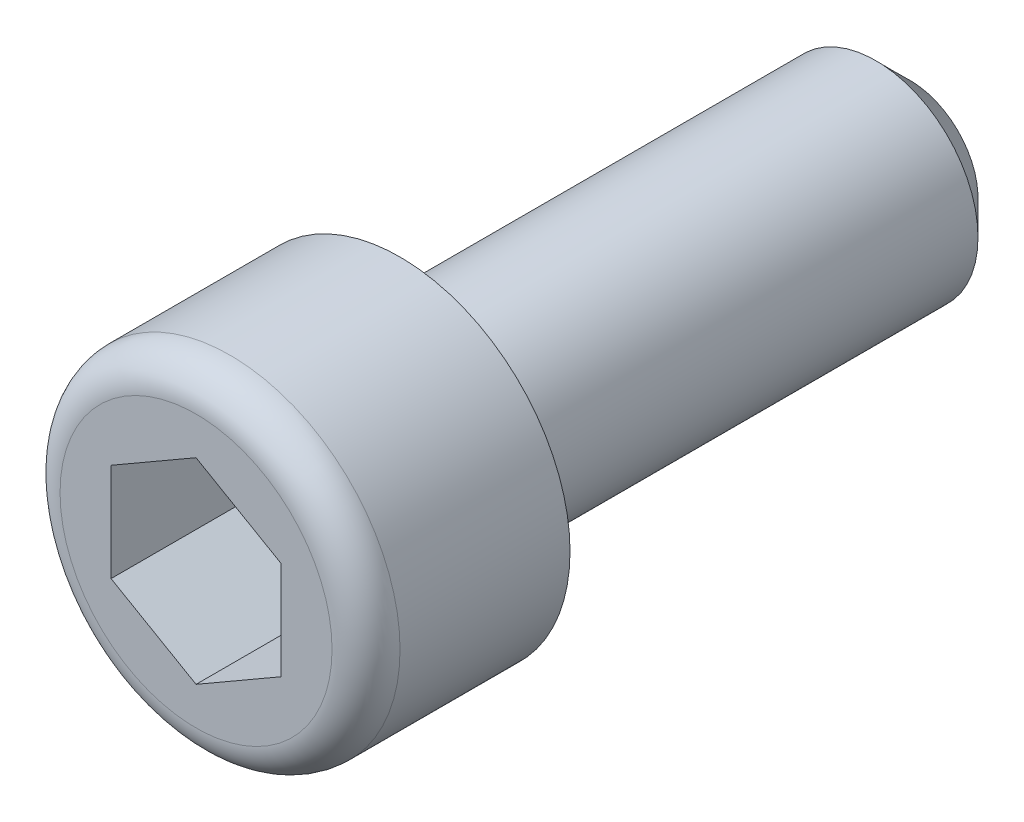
SolidWorks part; units mm, degrees
ref_plane "Face" through (0, 0, 0) normal (0, 0, 1) x (1, 0, 0)
ref_plane "Dessus" through (0, 0, 0) normal (0, 1, 0) x (1, 0, 0)
ref_plane "Droite" through (0, 0, 0) normal (1, 0, 0) x (0, 0, -1)
sketch "Esquisse1" plane through (0, 0, 0) normal (0, 0, 1) x (1, 0, 0)
  circle A0 centre (0, 0) radius 5
  dimension "D1" = 10
extrude "Base-Extrusion" add sketch "Esquisse1" against normal blind 6
sketch "Esquisse2" plane through (0, 0, -6) normal (0, 0, -1) x (-1, 0, 0)
  circle A0 centre (0, 0) radius 3
  dimension "D1" = 6
extrude "Boss.-Extru.1" add sketch "Esquisse2" along normal blind 15
chamfer "Chanfrein1" distance 1 angle 45 1 edges at (-3, 0, -21)
sketch "Esquisse3" plane through (0, 0, 0) normal (0, 0, 1) x (1, 0, 0)
  line L1 (-2.5, -1.4434) -> (0, -2.8868)
  line L2 (0, -2.8868) -> (2.5, -1.4434)
  line L3 (2.5, -1.4434) -> (2.5, 1.4434)
  line L4 (2.5, 1.4434) -> (0, 2.8868)
  line L5 (0, 2.8868) -> (-2.5, 1.4434)
  line L6 (-2.5, 1.4434) -> (-2.5, -1.4434)
  circle A0 centre (0, 0) radius 2.5 construction
  dimension "D1" = 5
extrude "Enlèv. mat.-Extru.1" cut sketch "Esquisse3" against normal blind 4
fillet "Congé1" radius 1 1 edges at (5, 0, 0)
